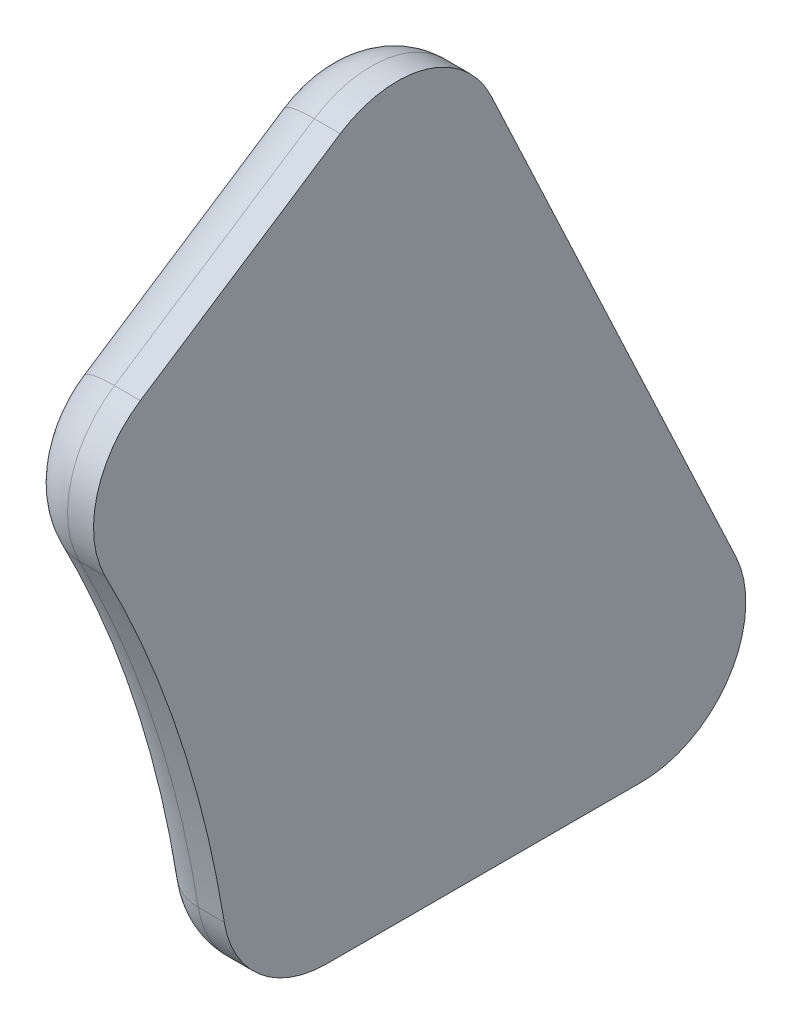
SolidWorks part; units mm, degrees
ref_plane "Alzado" through (0, 0, 0) normal (0, 0, 1) x (1, 0, 0)
ref_plane "Planta" through (0, 0, 0) normal (0, 1, 0) x (1, 0, 0)
ref_plane "Vista lateral" through (0, 0, 0) normal (1, 0, 0) x (0, 0, -1)
sketch "Croquis1" plane through (0, 0, 0) normal (1, 0, 0) x (0, 0, -1)
  line L0 (12994.1641, 4904.5983) -> (13041.3935, 4803.9869)
  line L1 (12962.4659, 4775.4882) -> (13023.289, 4775.4882)
  line L2 (12926.5321, 4887.5221) -> (12965.0874, 4912.8212)
  arc A0 (12994.1641, 4904.5983) -> (12965.0874, 4912.8212) centre (12976.0596, 4896.0996) ccw
  arc A1 (13023.289, 4775.4882) -> (13041.3935, 4803.9869) centre (13023.289, 4795.4882) ccw
  arc A2 (12942.7236, 4792.2882) -> (12919.7589, 4861.5756) centre (12715.6867, 4755.4882) ccw
  arc A3 (12942.7236, 4792.2882) -> (12962.4659, 4775.4882) centre (12962.4659, 4795.4882) ccw
  arc A4 (12926.5321, 4887.5221) -> (12919.7589, 4861.5756) centre (12937.5043, 4870.8005) ccw
extrude "Saliente-Extruir1" add sketch "Croquis1" along normal blind 15
fillet "Redondeo1" radius 10 8 edges at (0, 4900.1716, -12945.8097) (0, 4875.8521, -12918.1528) (0, 4827.8487, -12934.0075) (0, 4780.2567, -12949.5045) (0, 4775.4882, -12992.8775) (0, 4784.7638, -13040.1706) (0, 4854.2926, -13017.7788) (0, 4915.3449, -12981.5021)
